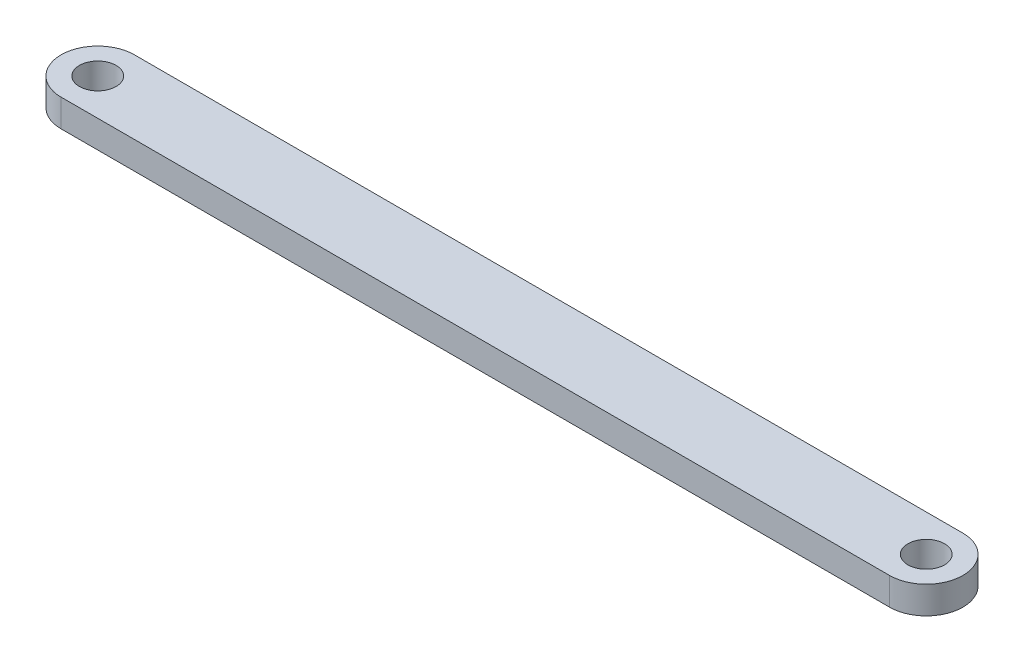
SolidWorks part; units mm, degrees
ref_plane "Vorderseite" through (0, 0, 0) normal (0, 0, 1) x (1, 0, 0)
ref_plane "Oben" through (0, 0, 0) normal (0, 1, 0) x (1, 0, 0)
ref_plane "Rechts" through (0, 0, 0) normal (1, 0, 0) x (0, 0, -1)
sketch "Skizze1" plane through (0, 0, 550) normal (0, 1, 0) x (1, 0, 0)
  line L1 (-530, -120) -> (-452, -120)
  line L3 (0, 0) -> (0, 2902.3)
  line L4 (0, 0) -> (0, -120)
  line L5 (0, -120) -> (0, -32.5)
  line L6 (0, -32.5) -> (-126, -32.5)
  line L7 (-530, 0) -> (530, 0) construction
  line L8 (530, 150) -> (530, -150)
  line L9 (-530, 150) -> (-530, -150)
  line L10 (530, -120) -> (452, -120)
  line L11 (-452, -120) -> (0, -120)
  line L12 (0, -120) -> (452, -120)
  line L13 (-530, -1040) -> (530, -1040) construction
  line L14 (0, 0) -> (0, -1040) construction
  line L15 (529.9542, -890) -> (530.0458, -1190)
  line L16 (-530.0526, -867.5292) -> (-529.9474, -1212.4708)
  line L17 (-530.0366, -920) -> (-452.0366, -919.9762)
  line L18 (529.9634, -920) -> (451.9634, -920.0238)
  line L19 (-0.0366, -920) -> (0, -1040)
  line L20 (-0.0099, -1007.5) -> (125.9901, -1007.4615)
  line L21 (-126, -32.5) -> (125.9901, -1007.4615)
  line L22 (-452.0366, -919.9762) -> (-0.0366, -920)
  line L23 (-0.0366, -920) -> (451.9634, -920.0238)
  line L24 (0, -1356) -> (0, -1040)
  line L25 (344.7172, -520) -> (0, -520)
  circle A0 centre (0, 0) radius 7.3181
  point P4 (0, 0)
  point P13 (0, 0)
  point P17 (-530, 0)
  point P19 (530, 0)
  point P30 (-530, -1040)
  point P31 (530, -1040)
  dimension "D3" = 2902.3
  dimension "D5" = 32.5
  dimension "D6" = 120
  dimension "D7" = 1060
  dimension "D8" = 78
  dimension "D9" = 120
  dimension "D10" = 120
  dimension "D11" = 452
  dimension "D14" = 300
  dimension "D15" = 1040
  dimension "D16" = 126
  dimension "D17" = 120
  dimension "D18" = 120
  dimension "D19" = 32.5
  dimension "D20" = 1007
  dimension "D21" = 316
sketch "Skizze2" plane through (0, 0, 0) normal (0, 1, 0) x (1, 0, 0)
  line L0 (-452, -650) -> (0, -650)
  line L2 (-452, -690) -> (0, -690)
  circle A0 centre (-452, -670) radius 10
  circle A1 centre (0, -670) radius 10
  arc A2 (0, -690) -> (0, -650) centre (0, -670) ccw
  arc A3 (-452, -650) -> (-452, -690) centre (-452, -670) ccw
  dimension "D1" = 20
  dimension "D2" = 40
extrude "Aufsatz-Linear austragen1" add sketch "Skizze2" along normal blind 15
